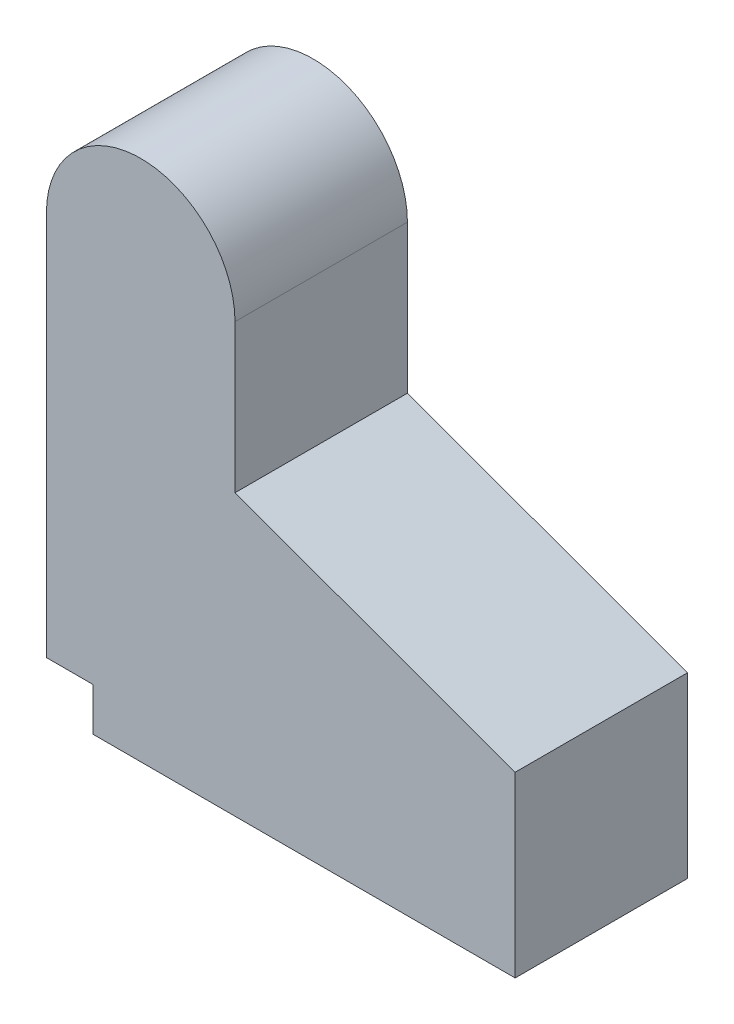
SolidWorks part; units mm, degrees
ref_plane "Face" through (0, 0, 0) normal (0, 0, 1) x (1, 0, 0)
ref_plane "Dessus" through (0, 0, 0) normal (0, 1, 0) x (1, 0, 0)
ref_plane "Droite" through (0, 0, 0) normal (1, 0, 0) x (0, 0, -1)
sketch "Esquisse1" plane through (0, 0, 0) normal (0, 0, 1) x (1, 0, 0)
  line L0 (4.3, 0) -> (43.5, 0)
  line L1 (43.5, 0) -> (43.5, 16.5368)
  line L2 (43.5, 16.5368) -> (17.5, 26)
  line L3 (17.5, 26) -> (17.5, 39.75)
  line L4 (4.3, 0) -> (4.3, 4)
  line L5 (4.3, 4) -> (0, 4)
  line L6 (0, 4) -> (0, 39.75)
  arc A0 (0, 39.75) -> (17.5, 39.75) centre (8.75, 39.75) cw
  dimension "D7" = 8.75
  dimension "D1" = 20
  dimension "D2" = 39.2
  dimension "D3" = 4
  dimension "D4" = 39.75
  dimension "D5" = 13.75
  dimension "D6" = 4.3
extrude "Extrusion1" add sketch "Esquisse1" along normal blind 16
